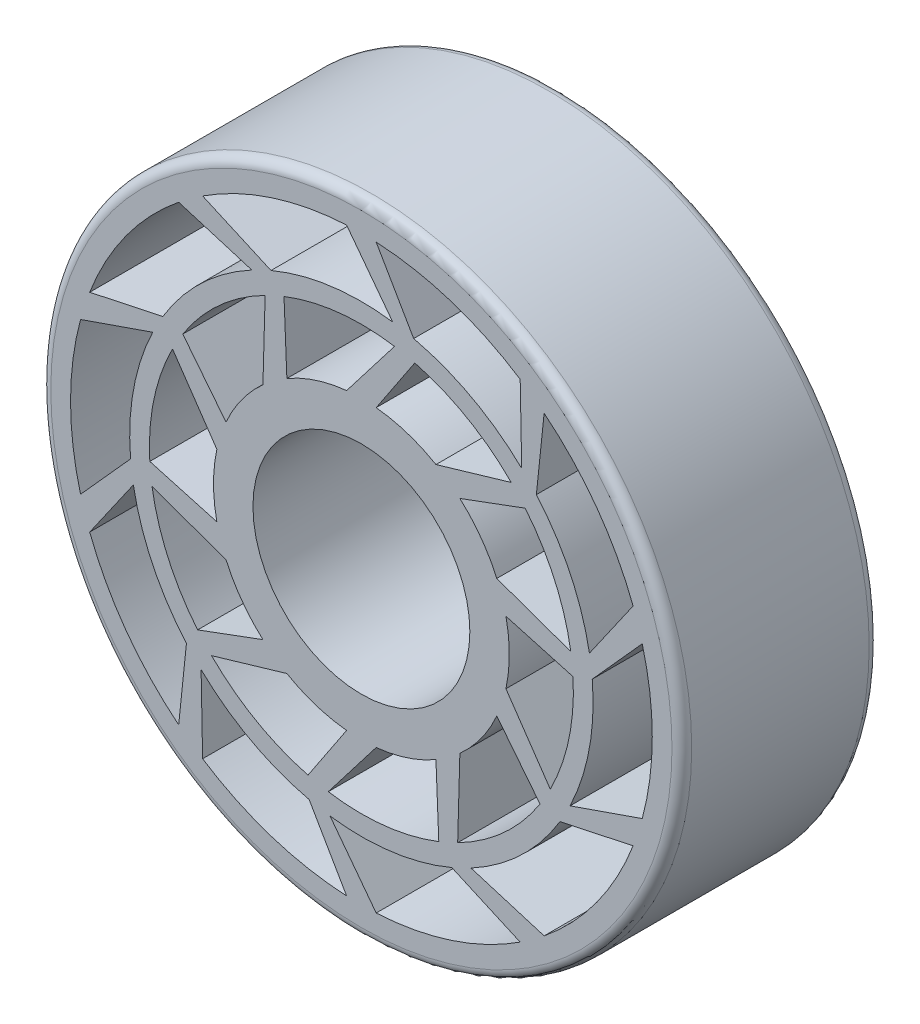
SolidWorks part; units mm, degrees
ref_plane "Front Plane" through (0, 0, 0) normal (0, 0, 1) x (1, 0, 0)
ref_plane "Top Plane" through (0, 0, 0) normal (0, 1, 0) x (1, 0, 0)
ref_plane "Right Plane" through (0, 0, 0) normal (1, 0, 0) x (0, 0, -1)
sketch "Sketch1" plane through (0, 0, 0) normal (0, 0, 1) x (1, 0, 0)
  line L0 (-1.5, -14.9248) -> (-6, -21.6852)
  line L1 (-6, -21.6852) -> (-1.5, -29.4618)
  line L2 (-4.0506, -22.1324) -> (1.5, -14.9248)
  line L3 (-4.0506, -22.1324) -> (1.5, -29.4618)
  line L4 (0, 0) -> (0, -32.5) construction
  line L5 (-1.5, -14.9248) -> (1.5, -14.9248) construction
  circle A0 centre (0, 0) radius 32.5
  circle A1 centre (0, 0) radius 11
  circle A2 centre (0, 0) radius 15
  circle A3 centre (0, 0) radius 29.5
  circle A4 centre (0, 0) radius 22.5 construction
  circle A5 centre (0, 0) radius 21.5
  circle A6 centre (0, 0) radius 23.5
  point P13 (-7.0501, -21.3669)
  point P16 (-9.1107, -20.5729)
  dimension "D1" = 65
  dimension "D2" = 22
  dimension "D3" = 3
  dimension "D4" = 4
  dimension "D5" = 45
  dimension "D8" = 1.5
  dimension "D10" = 1
  dimension "D11" = 1
  dimension "D6" = 1.5
  dimension "D7" = 1.5
  dimension "D9" = 1.5
  dimension "D12" = 6
  dimension "2" = 2
extrude "Boss-Extrude1" add sketch "Sketch1" along normal blind 20 contours A6 L1 A3 L3 | L1 A6 L3 L2 A5 L0 | L3 A6 L1 L0 A5 L2 | A0 A3 | L0 A5 L2 A2 | A2 A1
pattern_circular "CirPattern1" count 10 over 360 about axis through (0, 0, 0) along (0, 0, 1) of "Boss-Extrude1"
fillet "Fillet3" radius 1 2 edges at (32.5, 0, 20) (32.5, 0, 0)
